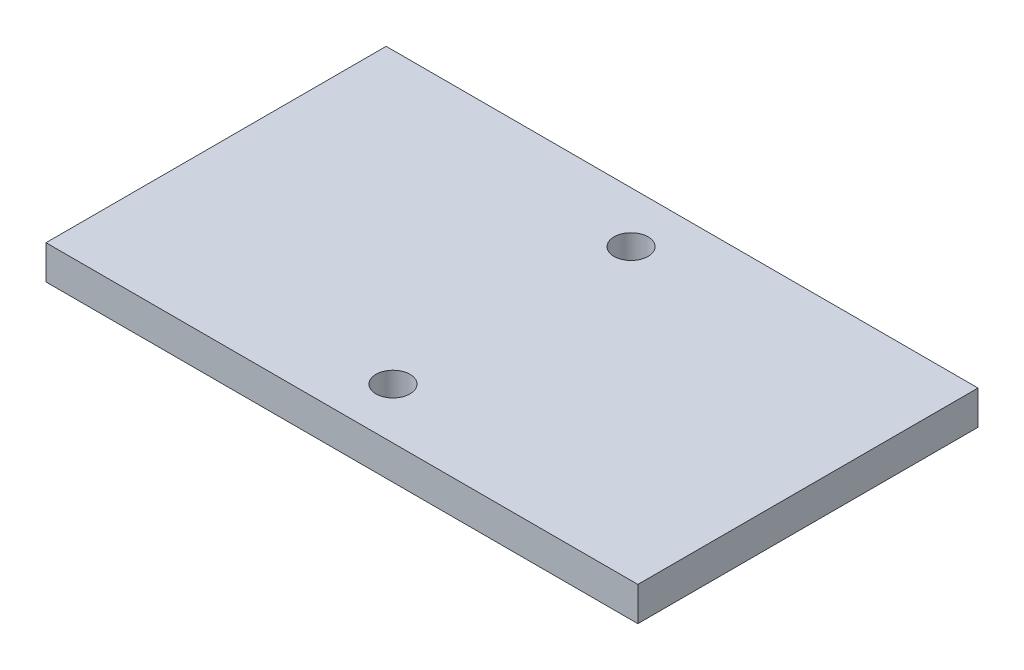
SolidWorks part; units mm, degrees
ref_plane "Front Plane" through (0, 0, 0) normal (0, 0, 1) x (1, 0, 0)
ref_plane "Top Plane" through (0, 0, 0) normal (0, 1, 0) x (1, 0, 0)
ref_plane "Right Plane" through (0, 0, 0) normal (1, 0, 0) x (0, 0, -1)
sketch "Sketch1" plane through (0, 0, 0) normal (0, 1, 0) x (1, 0, 0)
  line L1 (-8.7, -5) -> (8.7, -5)
  line L2 (-8.7, -5) -> (-8.7, 5)
  line L3 (-8.7, 5) -> (8.7, 5)
  line L4 (8.7, -5) -> (8.7, 5)
  line L5 (-8.7, -5) -> (8.7, 5) construction
  line L6 (-8.7, 5) -> (8.7, -5) construction
  point P0 (0, 0)
  dimension "D1" = 10
  dimension "D2" = 17.4
extrude "Boss-Extrude1" add sketch "Sketch1" along normal blind 1
sketch "Sketch2" plane through (0, 1, 0) normal (0, 1, 0) x (1, 0, 0)
  line L0 (0, -1000) -> (0, 49000) construction
  line L1 (-1000, 3.5) -> (49000, 3.5) construction
  line L2 (-1000, -3.5) -> (49000, -3.5) construction
  line L3 (8.7, 5) -> (-8.7, 5) construction
  line L4 (-8.7, -5) -> (8.7, -5) construction
  circle A0 centre (0, 3.5) radius 0.5
  circle A1 centre (0, -3.5) radius 0.5
  dimension "D2" = 1
  dimension "D1" = 1.5
  dimension "1.5" = 1.5
extrude "Cut-Extrude1" cut sketch "Sketch2" against normal through all
